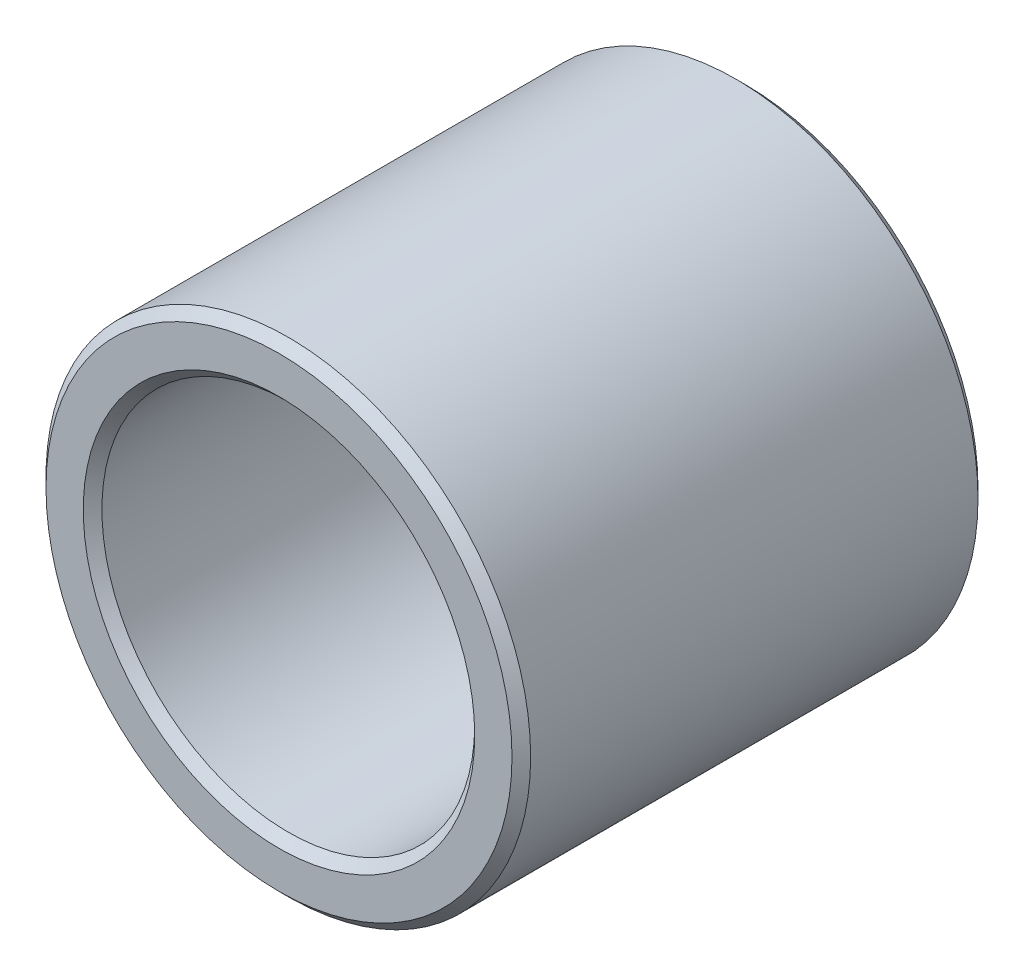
SolidWorks part; units mm, degrees
ref_plane "Plan1" through (0, 0, 0) normal (0, 0, 1) x (1, 0, 0)
ref_plane "Plan2" through (0, 0, 0) normal (0, 1, 0) x (1, 0, 0)
ref_plane "Plan3" through (0, 0, 0) normal (1, 0, 0) x (0, 0, -1)
sketch "Esquisse1" plane through (0, 0, 0) normal (0, 0, 1) x (1, 0, 0)
  circle A0 centre (0, 0) radius 10
  circle A1 centre (0, 0) radius 13
  dimension "D1" = 20
  dimension "D2" = 26
extrude "Base-Extrusion" add sketch "Esquisse1" against normal blind 25
chamfer "Chanfrein1" distance 0.5 angle 45
